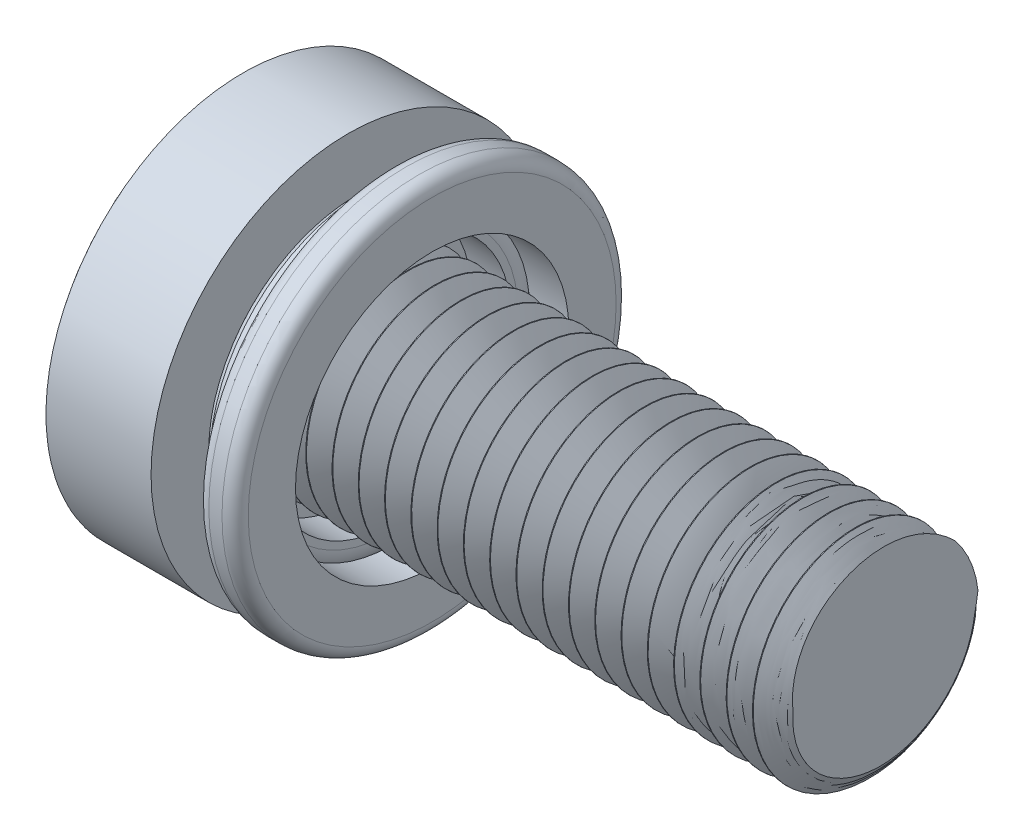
SolidWorks part; units mm, degrees
ref_plane "前视基准面" through (0, 0, 0) normal (0, 0, 1) x (1, 0, 0)
ref_plane "上视基准面" through (0, 0, 0) normal (0, 1, 0) x (1, 0, 0)
ref_plane "右视基准面" through (0, 0, 0) normal (1, 0, 0) x (0, 0, -1)
imported_body "输入4"
fillet "圆角1" radius 0.3
sketch "草图2" plane through (1.3, 0, 0) normal (1, 0, 0) x (0, 0, -1)
  circle A0 centre (0, 0) radius 1.5
  circle A1 centre (0, 0) radius 1.6
  dimension "D1" = 3
extrude "切除-拉伸1" cut sketch "草图2" against normal blind 10 contours A0 M3
ref_plane "基准面1" through (1.32, 0, 0) normal (1, 0, 0) x (0, 0, -1)
sketch "草图6" plane through (1.32, 0, 0) normal (1, 0, 0) x (0, 0, -1)
  circle A0 centre (0, 0) radius 0.9185
  circle A1 centre (0, 0) radius 1.1725
extrude "凸台-拉伸3" add sketch "草图6" along normal blind 0.3 separate body
fillet "圆角4" radius 0.2 1 edges at (1.62, 0, -1.1725)
fillet "圆角5" radius 0.2 1 edges at (1.32, 0, -1.1725)
ref_plane "基准面2" through (1.64, 0, 0) normal (1, 0, 0) x (0, 0, -1)
sketch "草图7" plane through (1.64, 0, 0) normal (1, 0, 0) x (0, 0, -1)
  circle A0 centre (0, 0) radius 1.5
  circle A1 centre (0, 0) radius 1.0406
extrude "凸台-拉伸4" add sketch "草图7" along normal blind 0.3 separate body
fillet "圆角6" radius 0.1 1 edges at (1.94, 0, -1.5)
fillet "圆角7" radius 0.1 1 edges at (1.64, 0, -1.5)
